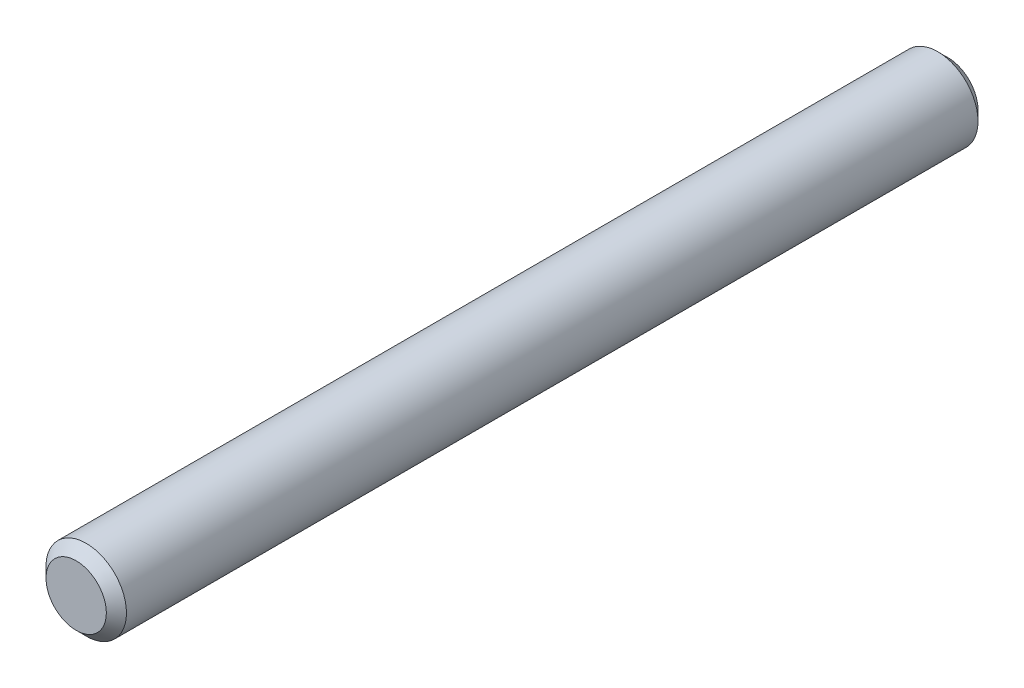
SolidWorks part; units mm, degrees
ref_plane "Face" through (0, 0, 0) normal (0, 0, 1) x (1, 0, 0)
ref_plane "Dessus" through (0, 0, 0) normal (0, 1, 0) x (1, 0, 0)
ref_plane "Droite" through (0, 0, 0) normal (1, 0, 0) x (0, 0, -1)
sketch "Esquisse1" plane through (0, 0, 0) normal (0, 0, 1) x (1, 0, 0)
  circle A0 centre (0, 0) radius 6
  dimension "D1" = 12
extrude "Extrusion1" add sketch "Esquisse1" against normal blind 130
chamfer "Chanfrein1" distance 1.5 angle 45 2 edges at (6, 0, -130) (6, 0, 0)
